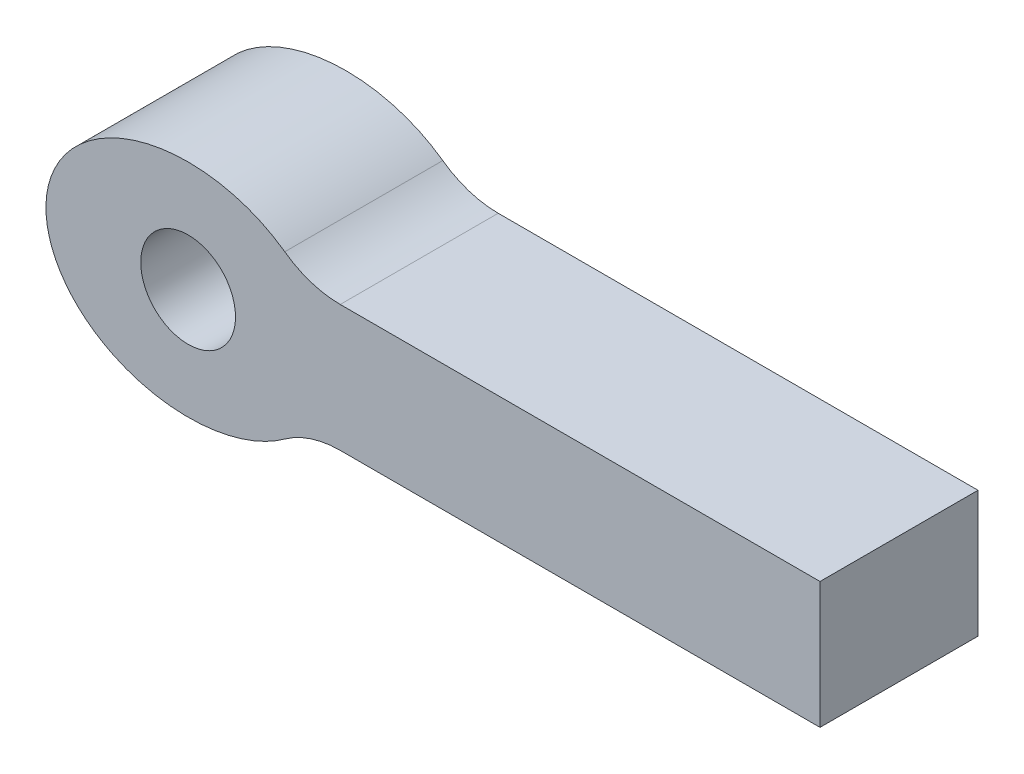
SolidWorks part; units mm, degrees
ref_plane "Płaszczyzna przednia" through (0, 0, 0) normal (0, 0, 1) x (1, 0, 0)
ref_plane "Płaszczyzna górna" through (0, 0, 0) normal (0, 1, 0) x (1, 0, 0)
ref_plane "Płaszczyzna prawa" through (0, 0, 0) normal (1, 0, 0) x (0, 0, -1)
sketch "Szkic1" plane through (0, 0, 0) normal (0, 0, 1) x (1, 0, 0)
  line L0 (4.8141, 2) -> (20, 2)
  line L1 (20, 2) -> (20, -2)
  line L2 (20, -2) -> (4.8141, -2)
  line L3 (0, 0) -> (20, 0) construction
  arc A1 (4.8141, -2) -> (3.0594, -2.5666) centre (4.8141, -5) ccw
  arc A2 (4.8141, 2) -> (3.0594, 2.5666) centre (4.8141, 5) cw
  circle A3 centre (0, 0) radius 1.5
  ellipse E0 centre (0, 0) end of major axis (4.5, 0) minor radius 3.5 (3.0594, 2.5666) -> (3.0594, -2.5666) ccw
  point P12 (-1.5, 0)
  dimension "Promień" = 3
  dimension "Fi" = 3
  dimension "Długość" = 20
  dimension "Szerokość" = 4
  dimension "G" = 7
  dimension "h" = 3
extrude "Dodanie-wyciągnięcie1" add sketch "Szkic1" along normal mid plane 5
